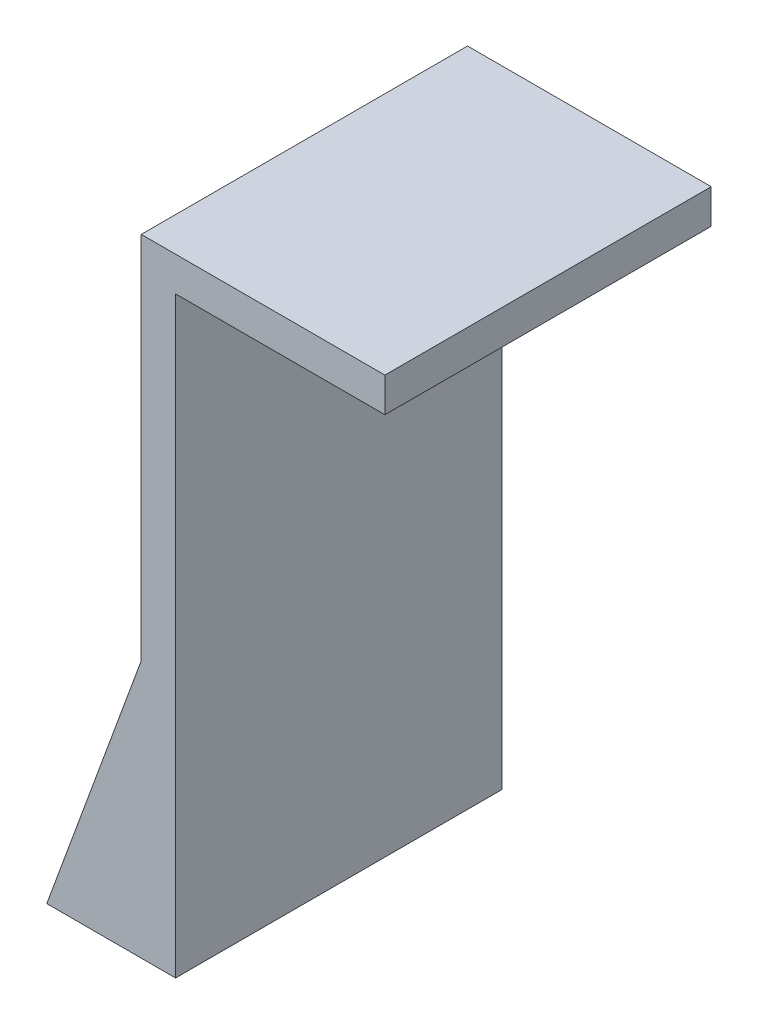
SolidWorks part; units mm, degrees
ref_plane "Planta" through (0, 0, 0) normal (0, 0, 1) x (1, 0, 0)
ref_plane "Perfil" through (0, 0, 0) normal (0, 1, 0) x (1, 0, 0)
ref_plane "Alzado" through (0, 0, 0) normal (1, 0, 0) x (0, 0, -1)
sketch "Croquis1" plane through (0, 0, 0) normal (0, 0, 1) x (1, 0, 0)
  line L9 (0, 0) -> (5.5, 15)
  line L10 (5.5, 15) -> (5.5, 36.5)
  line L11 (5.5, 36.5) -> (19.6896, 36.5)
  line L12 (19.6896, 36.5) -> (19.6896, 34.5)
  line L13 (19.6896, 34.5) -> (7.5, 34.5)
  line L14 (7.5, 34.5) -> (7.5, 0)
  line L15 (7.5, 0) -> (0, 0)
  dimension "D1" = 7.5
  dimension "D2" = 36.5
  dimension "D3" = 2
  dimension "D4" = 15
  dimension "D5" = 2
extrude "Saliente-Extruir1" add sketch "Croquis1" along normal blind 19
